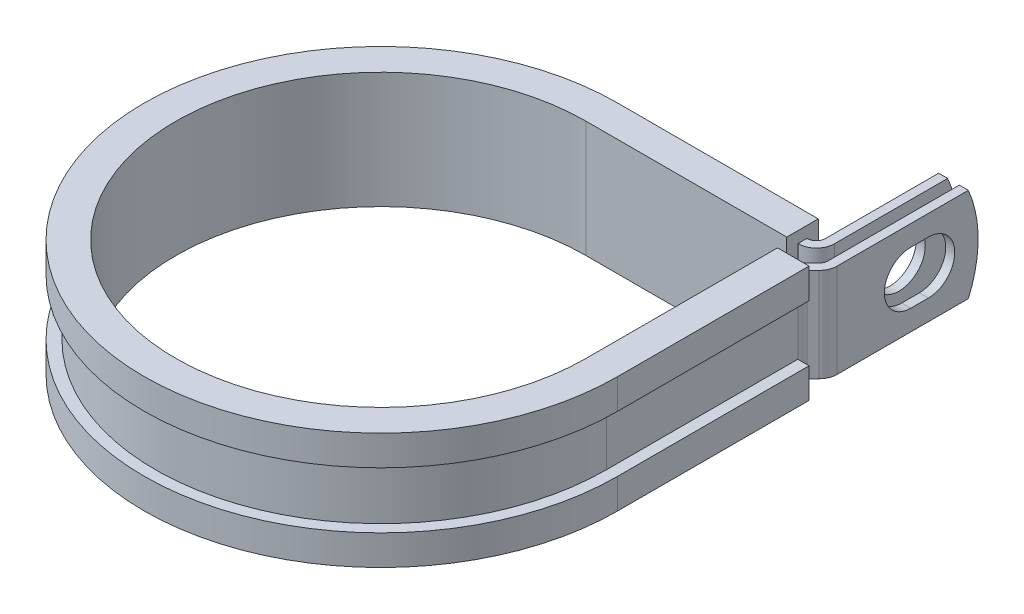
SolidWorks part; units mm, degrees
ref_plane "Front Plane" through (0, 0, 0) normal (0, 0, 1) x (1, 0, 0)
ref_plane "Top Plane" through (0, 0, 0) normal (0, 1, 0) x (1, 0, 0)
ref_plane "Right Plane" through (0, 0, 0) normal (1, 0, 0) x (0, 0, -1)
sketch "Sketch1" plane through (0, 0, 0) normal (0, 1, 0) x (1, 0, 0)
  line L0 (0, 29.2989) -> (27.1832, 29.2989)
  line L1 (29.2989, 0) -> (29.2989, 25.8864)
  line L2 (29.6216, 48.387) -> (29.6216, 31.7373)
  line L3 (30.0131, 27.6106) -> (30.8393, 28.4368)
  line L5 (31.1964, 29.2989) -> (31.1964, 48.387)
  arc A0 (0, 29.2989) -> (29.2989, 0) centre (0, 0) ccw
  arc A1 (30.0131, 27.6106) -> (29.2989, 25.8864) centre (31.7373, 25.8864) ccw
  arc A2 (30.8393, 28.4368) -> (31.1964, 29.2989) centre (29.9772, 29.2989) ccw
  arc A3 (27.1832, 29.2989) -> (29.6216, 31.7373) centre (27.1832, 31.7373) ccw
extrude "Extrude-Thin1" add sketch "Sketch1" along normal mid plane 12.7 thin
sketch "Sketch2" plane through (28.4024, 0, 0) normal (-1, 0, 0) x (0, 0, 1)
  line L0 (-48.387, 6.35) -> (-48.387, -6.35) construction
  line L1 (0, 6.35) -> (0, -6.35) construction
  circle A0 centre (-40.4622, 0) radius 3.5687
  point P2 (-48.387, 0)
extrude "Cut-Extrude1" cut sketch "Sketch2" against normal up to surface (1.2192 mm away)
sketch "Sketch3" plane through (32.4156, 0, 0) normal (1, 0, 0) x (0, 0, -1)
  line L0 (39.2684, 0) -> (41.656, 0) construction
  line L1 (39.2684, 3.5687) -> (41.656, 3.5687)
  line L2 (39.2684, -3.5687) -> (41.656, -3.5687)
  line L3 (48.387, 6.35) -> (48.387, -6.35) construction
  arc A0 (39.2684, 3.5687) -> (39.2684, -3.5687) centre (39.2684, 0) ccw
  arc A1 (41.656, -3.5687) -> (41.656, 3.5687) centre (41.656, 0) ccw
  point P3 (40.4622, 0)
  point P8 (48.387, 0)
  point P11 (35.6997, 0)
  point P12 (45.2247, 0)
extrude "Cut-Extrude2" cut sketch "Sketch3" against normal up to surface (1.2192 mm away)
sketch "Sketch4" plane through (28.4024, 0, 0) normal (-1, 0, 0) x (0, 0, 1)
  line L0 (-48.387, 6.35) -> (-48.387, -6.35)
  line L1 (-48.387, 6.35) -> (-47.0617, 6.35)
  line L2 (-48.387, 6.35) -> (-31.7373, 6.35) construction
  line L3 (-48.387, -6.35) -> (-47.0617, -6.35)
  line L4 (-48.387, -6.35) -> (-31.7373, -6.35) construction
  arc A0 (-47.0617, 6.35) -> (-47.0617, -6.35) centre (-32.512, 0) ccw
extrude "Cut-Extrude3" cut sketch "Sketch4" against normal through all contours A0 M4 M5 | A0 L0 M2
ref_plane "Plane1" through (0, 0, -25.8864) normal (0, 0, -1) x (-1, 0, 0)
ref_plane "Plane2" through (27.1324, 0, 0) normal (-1, 0, 0) x (0, 0, 1)
sketch "Sketch5" plane through (0, 0, -25.8864) normal (0, 0, -1) x (-1, 0, 0)
  line L0 (-30.5181, 6.35) -> (-29.2989, 6.35)
  line L1 (-30.5181, 6.35) -> (-30.5181, -6.35) construction
  line L3 (-29.2989, 6.35) -> (-29.2989, -6.35)
  line L4 (-29.2989, -6.35) -> (-30.5181, -6.35)
  line L5 (-30.5181, -6.35) -> (-30.5181, -3.81)
  line L6 (-30.5181, 6.35) -> (-30.5181, 3.81)
  line L7 (-32.0421, 7.874) -> (-32.0421, 3.81)
  line L8 (-32.0421, 7.874) -> (-27.7749, 7.874)
  line L9 (-27.7749, 7.874) -> (-27.7749, -7.874)
  line L10 (-27.7749, -7.874) -> (-32.0421, -7.874)
  line L11 (-32.0421, -7.874) -> (-32.0421, -3.81)
  line L12 (-32.0421, 3.81) -> (-30.5181, 3.81)
  line L13 (-30.5181, -3.81) -> (-32.0421, -3.81)
sketch "Sketch6" plane through (0, 6.35, 0) normal (0, 1, 0) x (1, 0, 0)
  line L0 (27.7749, 0) -> (27.7749, 25.8864)
  line L1 (27.7749, 25.8864) -> (32.0421, 25.8864) construction
  line L2 (27.1324, 6.9878) -> (27.1324, -6.9878) construction
  line L5 (0, 27.7749) -> (27.1324, 27.7749)
  arc A0 (0, 27.7749) -> (27.7749, 0) centre (0, 0) ccw
sweep "Sweep1" add profiles "Sketch5" path "Sketch6"
equation "\"D4@Sketch5\" = \"D1@Extrude-Thin1\""
equation "\"D5@Sketch5\" = \"D5@Extrude-Thin1\""
equation "\"D1@Sketch3\" = \"D2@Sketch2\""
equation "\"D7@Sketch1\" = \"D3@Sketch2\" + \"D1@Sketch3\""
equation "\"D1@Sketch1\" = \"D1@Sketch6\" + 2 * \"D3@Sketch5\""
equation "\"D1@Sketch4\" = ( \"D1@Extrude-Thin1\" + .125 ) * 2"
equation "\"D9@Sketch1\"= \"D5@Extrude-Thin1\""
equation "\"D8@Sketch1\"= 2 * \"D5@Extrude-Thin1\""
equation "\"D2@Sketch1\" = 2 * \"D5@Extrude-Thin1\""
equation "\"D2@Sketch3\" = \"D1@Sketch2\""
